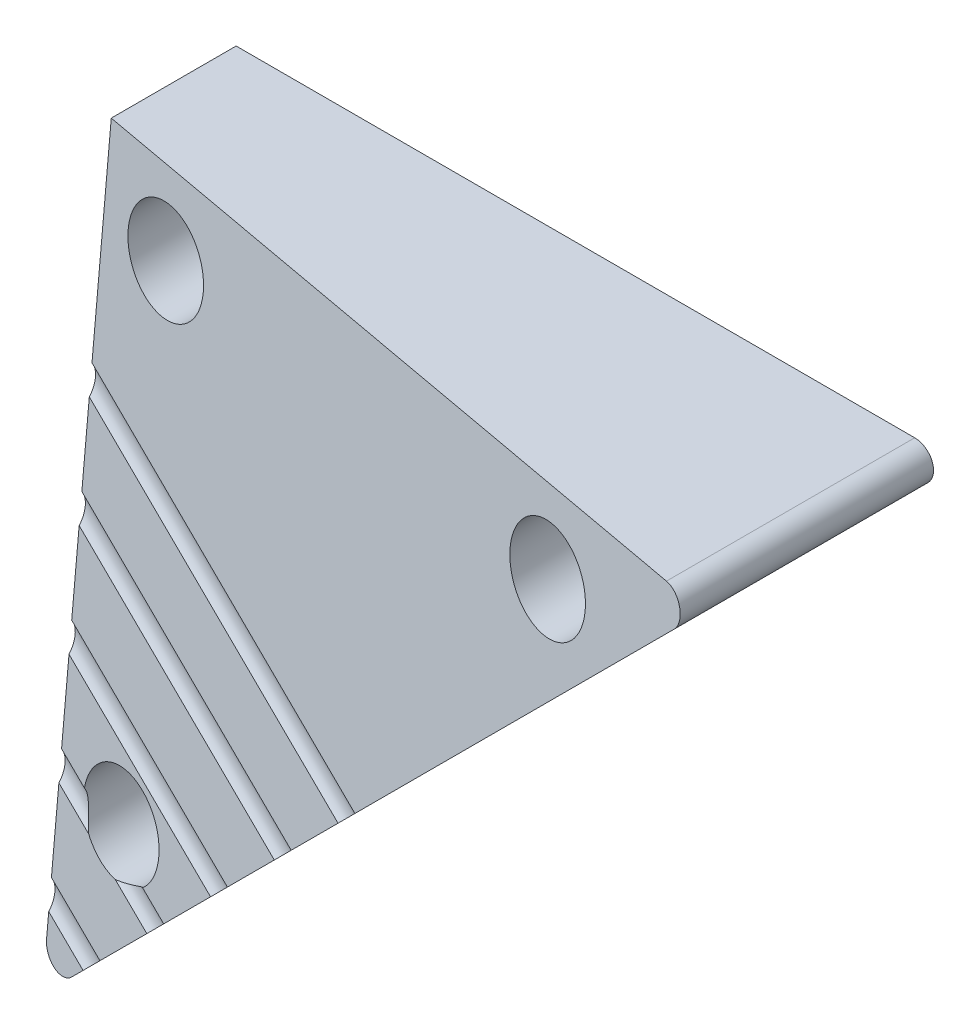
SolidWorks part; units mm, degrees
ref_plane "Front" through (0, 0, 0) normal (0, 0, 1) x (1, 0, 0)
ref_plane "Top" through (0, 0, 0) normal (0, 1, 0) x (1, 0, 0)
ref_plane "Right" through (0, 0, 0) normal (1, 0, 0) x (0, 0, -1)
sketch "Sketch1" plane through (0, 0, 0) normal (0, 0, 1) x (1, 0, 0)
  line L0 (-1196.34, 25.4) -> (-1196.34, -180.975) construction
  line L2 (-745.49, 149.225) -> (-1072.515, 149.225) construction
  line L3 (-1196.34, 149.225) -> (-1196.34, 27.1961)
  line L5 (-1074.3111, 149.225) -> (-1196.34, 149.225)
  line L7 (-1197.238, 26.298) -> (-1073.413, 150.123)
  line L8 (-1196.34, 27.1961) -> (-1074.3111, 149.225)
  dimension "D1" = 1.27
extrude "Boss-Extrude1" add sketch "Sketch1" along normal blind 44.45 separate body
fillet "Fillet1" radius 3.175 2 edges at (-1074.3111, 149.225, 22.225) (-1196.34, 27.1961, 22.225)
ref_plane "Plane2" through (0, 0, 44.45) normal (0, 0, 1) x (1, 0, 0)
hole_wizard "Hole1" positions "Point_Sketch" profile "Profil_Sketch" counterbore size "1/4" standard "ANSI Inch"
sketch "Point_Sketch" plane through (-1196.5091, 137.46, 44.45) normal (0, 0, -1) x (1, 0, 0)
  point P0 (12.8691, 0.935)
  point P2 (12.8691, 79.6034)
  point P4 (91.5375, 0.935)
sketch "Profil_Sketch" plane through (-1183.64, 136.525, 44.45) normal (1, 0, 0) x (0, -1, 0)
  line L0 (0, 0) -> (0, 44.45)
  line L1 (0, 44.45) -> (5.1562, 44.45)
  line L3 (5.1562, 44.45) -> (5.1562, 36.576)
  line L4 (5.1562, 36.576) -> (7.7343, 36.576)
  line L5 (7.7343, 36.576) -> (7.7343, 0)
  line L7 (7.7343, 0) -> (0, 0)
  line L11 (0, -6.35) -> (0, 107.95) construction
  dimension "Diameter" = 10.3124
  dimension "Thru Hole Depth" = 44.45
  dimension "L1" = 36.576
other "usin_LS160_.375-16x1-SHCS<1>"
ref_plane "Plane1" through (-36.348, 19.0606, 244.3642) normal (0.1781, -0.0934, -0.9796) x (-0.984, -0.0169, -0.1773)
other "SurfaceCut1"
ref_plane "Plane3" through (-861.9005, 451.9722, -199.8019) normal (-0.8675, 0.4549, -0.2011) x (-0.1781, 0.0934, 0.9796)
sketch "Sketch2" plane through (-861.9005, 451.9722, -199.8019) normal (-0.8675, 0.4549, -0.2011) x (-0.1781, 0.0934, 0.9796)
  circle A1 centre (250.0069, -503.357) radius 3.175
  circle A2 centre (250.0069, -503.357) radius 3.175
  circle A3 centre (250.0069, -487.482) radius 3.175
  circle A4 centre (250.0069, -487.482) radius 3.175
  circle A5 centre (250.0069, -471.607) radius 3.175
  circle A6 centre (250.0069, -471.607) radius 3.175
  circle A7 centre (250.0069, -455.732) radius 3.175
  circle A8 centre (250.0069, -455.732) radius 3.175
  circle A9 centre (250.0069, -519.232) radius 3.175
  circle A10 centre (250.0069, -519.232) radius 3.175
  dimension "D1" = 0
  dimension "D2" = 0
  dimension "D3" = 0
  dimension "D4" = 0
  dimension "D5" = 0
extrude "Cut-Extrude1" cut sketch "Sketch2" along normal through all
ref_plane "Plane4" through (-211.6467, -403.6054, 0) normal (0.4644, 0.8856, 0) x (0.8675, -0.4549, 0.2011)
ref_point "Point2"
ref_plane "Plane6" through (0, 0, 43.2333) normal (0, 0, -1) x (-1, 0, 0)
